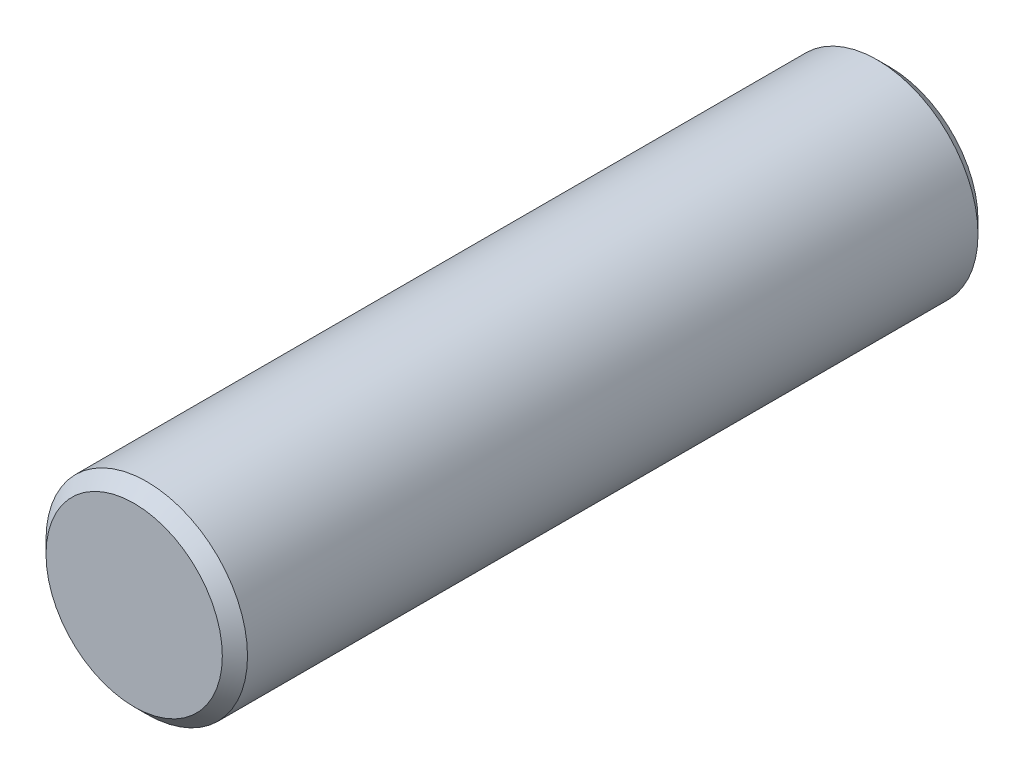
SolidWorks part; units mm, degrees
ref_plane "Face" through (0, 0, 0) normal (0, 0, 1) x (1, 0, 0)
ref_plane "Dessus" through (0, 0, 0) normal (0, 1, 0) x (1, 0, 0)
ref_plane "Droite" through (0, 0, 0) normal (1, 0, 0) x (0, 0, -1)
sketch "Esquisse1" plane through (0, 0, 0) normal (0, 0, 1) x (1, 0, 0)
  circle A0 centre (0, 0) radius 8
  dimension "D1" = 16
extrude "Base-Extrusion" add sketch "Esquisse1" along normal blind 60
chamfer "Chanfrein1" distance 1 angle 45
